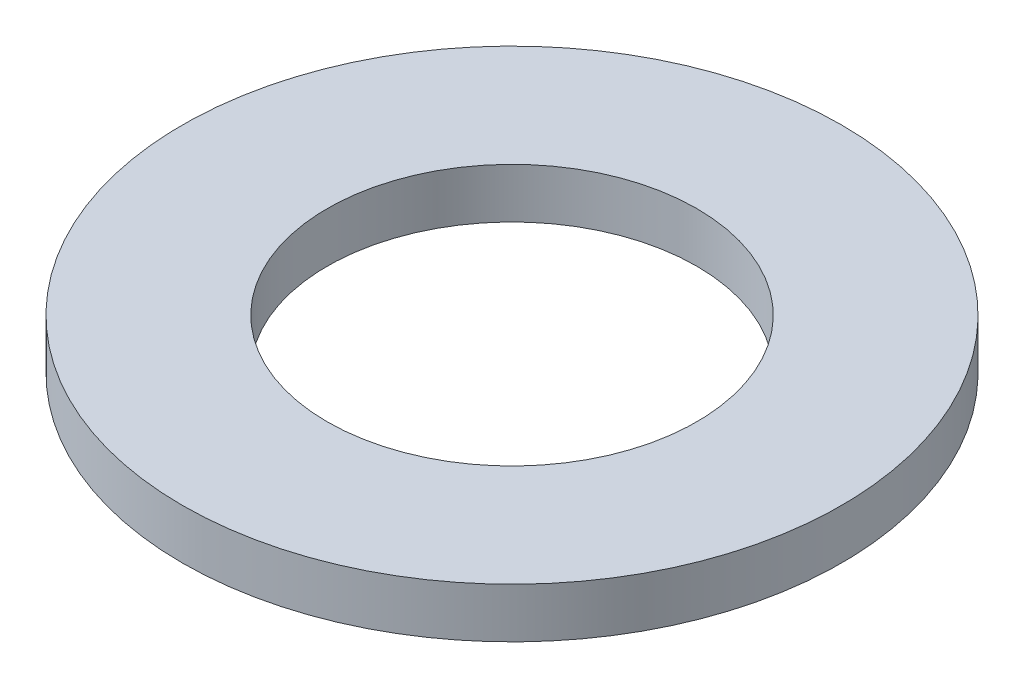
SolidWorks part; units mm, degrees
ref_plane "Front" through (0, 0, 0) normal (0, 0, 1) x (1, 0, 0)
ref_plane "Top" through (0, 0, 0) normal (0, 1, 0) x (1, 0, 0)
ref_plane "Right" through (0, 0, 0) normal (1, 0, 0) x (0, 0, -1)
sketch "Sketch1" plane through (0, 0, 0) normal (0, 1, 0) x (1, 0, 0)
  circle A0 centre (0, 0) radius 18.5
  circle A1 centre (0, 0) radius 33
extrude "Extrude1" add sketch "Sketch1" along normal blind 5
